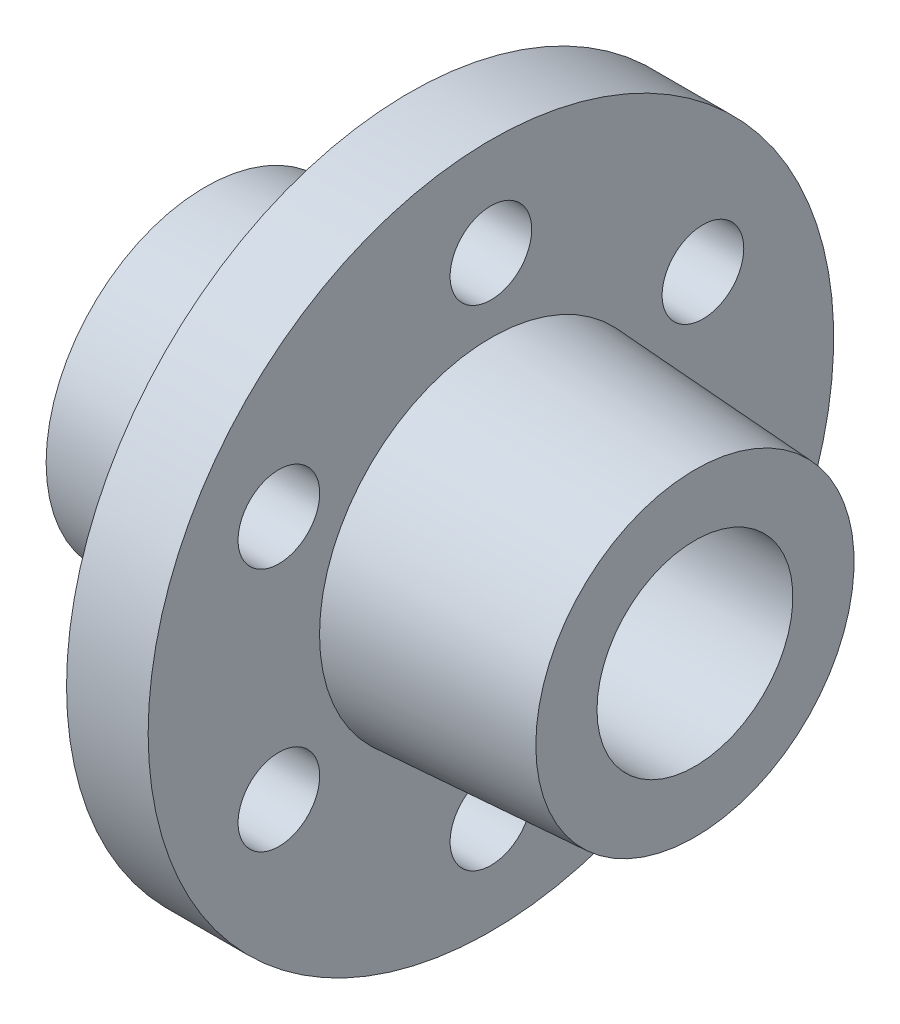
SolidWorks part; units mm, degrees
ref_plane "Front" through (0, 0, 0) normal (0, 0, 1) x (1, 0, 0)
ref_plane "Top" through (0, 0, 0) normal (0, 1, 0) x (1, 0, 0)
ref_plane "Right" through (0, 0, 0) normal (1, 0, 0) x (0, 0, -1)
sketch "Sketch1" plane through (0, 0, 0) normal (0, 0, 1) x (1, 0, 0)
  line L0 (-30, 0) -> (30, 0) construction
  line L2 (30, 12) -> (-30, 12)
  line L4 (0, 0) -> (0, 42) construction
  line L5 (-5, 42) -> (5, 42)
  line L6 (5, 42) -> (5, 21)
  line L7 (5, 21) -> (30, 19.5)
  line L8 (30, 19.5) -> (30, 12)
  line L9 (-30, 19.5) -> (-30, 12)
  line L10 (-5, 21) -> (-30, 19.5)
  line L11 (-5, 42) -> (-5, 21)
  dimension "D1" = 60
  dimension "D2" = 24
  dimension "D3" = 84
  dimension "D4" = 10
  dimension "D5" = 39
  dimension "D6" = 42
revolve "Revolve1" add sketch "Sketch1" angle 360 about L0
sketch "Sketch2" plane through (5, 0, 0) normal (1, 0, 0) x (0, 0, -1)
  circle A0 centre (0, 0) radius 30 construction
  circle A1 centre (0, 30) radius 5
  circle A2 centre (25.9808, 15) radius 5
  circle A3 centre (25.9808, -15) radius 5
  circle A4 centre (0, -30) radius 5
  circle A5 centre (-25.9808, -15) radius 5
  circle A6 centre (-25.9808, 15) radius 5
  dimension "D1" = 60
  dimension "D2" = 10
  dimension "D3" = 6
extrude "Cut-Extrude1" cut sketch "Sketch2" against normal through all
